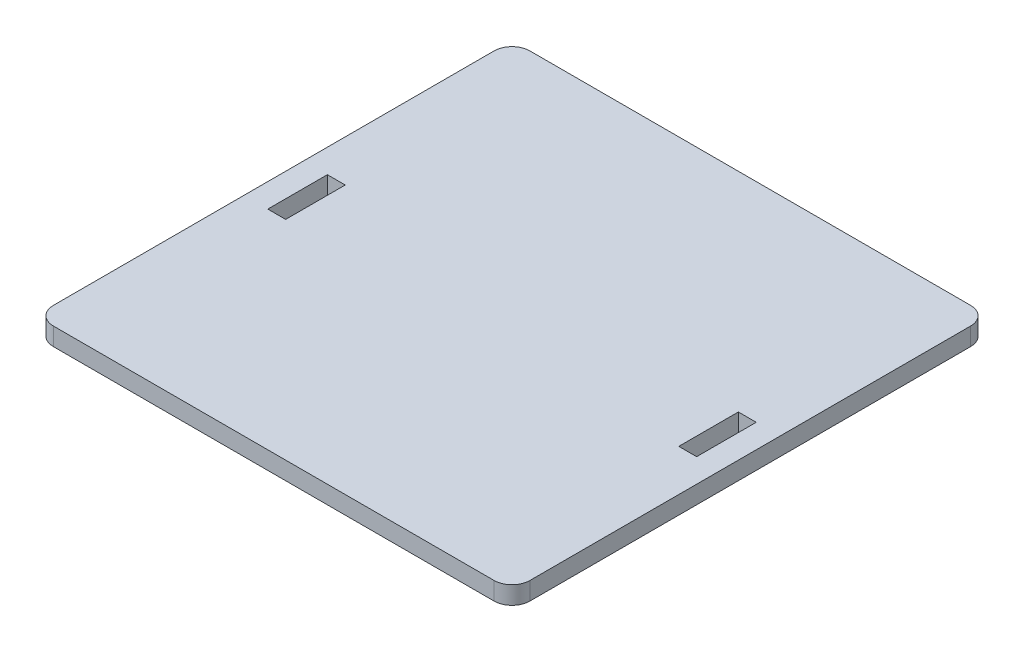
SolidWorks part; units mm, degrees
ref_plane "Front Plane" through (0, 0, 0) normal (0, 0, 1) x (1, 0, 0)
ref_plane "Top Plane" through (0, 0, 0) normal (0, 1, 0) x (1, 0, 0)
ref_plane "Right Plane" through (0, 0, 0) normal (1, 0, 0) x (0, 0, -1)
sketch "Sketch1" plane through (0, 0, 0) normal (0, 1, 0) x (1, 0, 0)
  line L0 (0, 0) -> (0, 160) construction
  line L1 (-74, 0) -> (74, 0)
  line L2 (-80, 6) -> (-80, 154)
  line L3 (-74, 160) -> (74, 160)
  line L4 (80, 6) -> (80, 154)
  line L5 (-72, 90) -> (-66, 90)
  line L6 (-72, 90) -> (-72, 70)
  line L7 (-72, 70) -> (-66, 70)
  line L8 (-66, 90) -> (-66, 70)
  line L9 (72, 70) -> (66, 70)
  line L10 (66, 90) -> (66, 70)
  line L11 (72, 90) -> (66, 90)
  line L12 (72, 90) -> (72, 70)
  arc A0 (74, 160) -> (80, 154) centre (74, 154) cw
  arc A1 (74, 0) -> (80, 6) centre (74, 6) ccw
  arc A2 (-74, 0) -> (-80, 6) centre (-74, 6) cw
  arc A3 (-80, 154) -> (-74, 160) centre (-74, 154) cw
  point P4 (0, 0)
  point P10 (-72, 80)
  point P11 (-80, 80)
  point P22 (80, 0)
  point P25 (-80, 0)
  point P28 (-80, 160)
  dimension "D6" = 6
  dimension "D1" = 6
  dimension "D2" = 8
  dimension "D3" = 160
  dimension "D4" = 160
  dimension "D5" = 20
extrude "Boss-Extrude1" add sketch "Sketch1" along normal blind 6
